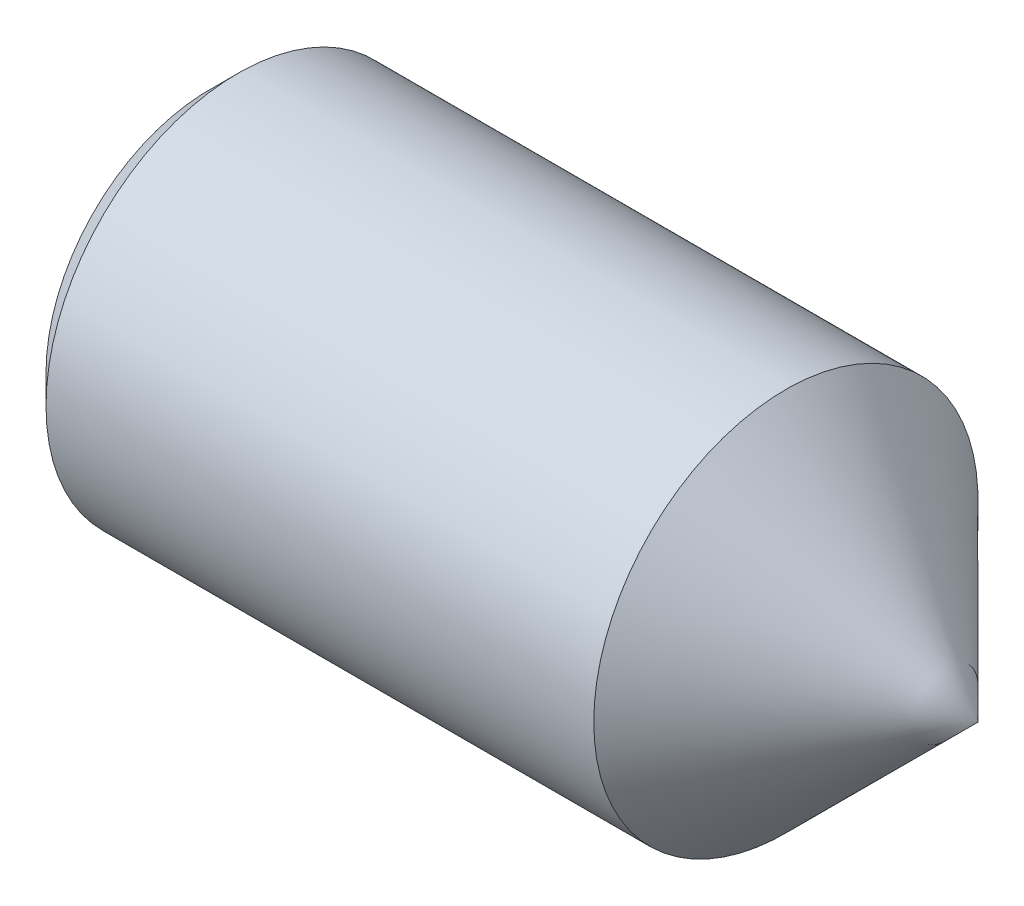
SolidWorks part; units mm, degrees
ref_plane "Plane1" through (0, 0, 0) normal (0, 0, 1) x (1, 0, 0)
ref_plane "Plane2" through (0, 0, 0) normal (0, 1, 0) x (1, 0, 0)
ref_plane "Plane3" through (0, 0, 0) normal (1, 0, 0) x (0, 0, -1)
sketch "BodySke" plane through (0, 0, 0) normal (0, 0, 1) x (1, 0, 0)
  line L0 (0, 0) -> (0, 10.8102)
  line L1 (0, 10.8102) -> (1.8898, 12.7)
  line L2 (1.8898, 12.7) -> (38.1, 12.7)
  line L3 (38.1, 12.7) -> (50.8, 0)
  line L4 (50.8, 0) -> (0, 0)
  line L5 (-12.7, 0) -> (88.9, 0) construction
  line L6 (38.1, -12.7) -> (50.8, 0) construction
  line L7 (1.0541, 15.875) -> (1.0541, -3.175) construction
  line L8 (0, -10.8102) -> (1.8898, -12.7) construction
  dimension "Cone_ang" = 90
  dimension "Length" = 50.8
  dimension "Diameter" = 25.4
  dimension "Drive_ch_ang" = 45
  dimension "Minor_dia" = 21.6205
  dimension "Advance" = 2.1082
revolve "BaseBody" add sketch "BodySke" angle 360 about L5
sketch "Sketch2" plane through (0, 0, 0) normal (-1, 0, 0) x (0, 0, 1)
  line L0 (4.1208, 7.1374) -> (-4.1208, 7.1374)
  line L1 (-4.1208, 7.1374) -> (-8.2416, 0)
  line L2 (4.1208, 7.1374) -> (8.2416, 0)
  line L3 (4.1208, -7.1374) -> (8.2416, 0)
  line L4 (4.1208, -7.1374) -> (-4.1208, -7.1374)
  line L5 (-4.1208, -7.1374) -> (-8.2416, 0)
  dimension "Hex_size" = 14.2748
  dimension "D2" = 7.1374
  dimension "D3" = 7.1374
extrude "Hex" cut sketch "Sketch2" against normal blind 14.2748
sketch "Sketch4" plane through (0, 4.7709, -0.5249) normal (-1, 0, 0) x (0, 0, 1)
  line L0 (0.5249, -4.7709) -> (10.6976, -4.7709)
  line L1 (0.5249, -4.7709) -> (6.6732, -1.2211) construction
  line L2 (0.5249, -4.7709) -> (5.6112, 4.0389)
  line L3 (8.9666, -2.6687) -> (10.2861, -1.9069)
  line L4 (6.5663, 1.4888) -> (7.8858, 2.2506)
  arc A0 (8.9666, -2.6687) -> (6.5663, 1.4888) centre (0.5249, -4.7709) ccw
  arc A1 (10.6976, -4.7709) -> (10.2861, -1.9069) centre (0.5249, -4.7709) ccw
  arc A2 (5.6112, 4.0389) -> (7.8858, 2.2506) centre (0.5249, -4.7709) cw
  circle A3 centre (0.5249, -4.7709) radius 8.6995 construction
  circle A4 centre (0.5249, -4.7709) radius 10.1727 construction
  dimension "D1" = 30
  dimension "Spline_n_dim" = 17.399
  dimension "Spline_m_dim" = 20.3454
  dimension "Spline_a_dim" = 60
  dimension "D3" = 2.4003
  dimension "Spline_p_dim" = 4.8006
extrude "Spline" [suppressed] cut sketch "Sketch4" against normal blind 12.7
pattern_circular "CirPattern1" [suppressed] count 6 every 60 about axis through (-12.7, 0, 0) along (1, 0, 0)
sketch "ThdSchSke" plane through (0, 0, 0) normal (0, 0, 1) x (1, 0, 0)
  line L0 (1.8898, -10.8102) -> (0.5665, -12.7)
  line L1 (1.8898, -10.8102) -> (3.213, -12.7)
  line L2 (3.213, -12.7) -> (3.213, -15.875)
  line L3 (-3.175, 0) -> (5.1513, 0) construction
  line L4 (1.8898, 12.7) -> (1.8898, -12.7) construction
  line L5 (3.213, -15.875) -> (0.5665, -15.875)
  line L6 (0.5665, -15.875) -> (0.5665, -12.7)
  dimension "Thread_minor" = 21.6205
  dimension "Diameter" = 25.4
  dimension "SideAngle" = 55
  dimension "VeeAngle" = 70
  dimension "Overcut" = 31.75
revolve "ThreadSchematic" [suppressed] cut sketch "ThdSchSke" angle 360 about L3
pattern_linear "ThdSchPat" [suppressed]
equation "\"D2@Sketch2\" = \"Hex_size@Sketch2\" / 2"
equation "\"D3@Sketch2\" = \"Hex_size@Sketch2\" / 2"
equation "\"Thread_minor@ThreadCosmetic\" = \"Minor_dia@BodySke\""
equation "\"D1@Sketch4\" = \"Spline_a_dim@Sketch4\" / 2"
equation "\"D3@Sketch4\" = \"Spline_p_dim@Sketch4\" / 2"
equation "\"D2@CirPattern1\" = \"Spline_a_dim@Sketch4\""
equation "\"Num_teeth@CirPattern1\" = 360 / \"D2@CirPattern1\""
equation "\"Thread_minor@ThdSchSke\" = \"Thread_minor@ThreadCosmetic\""
equation "\"Diameter@ThdSchSke\" = \"Diameter@BodySke\""
equation "\"Overcut@ThdSchSke\" = \"Diameter@BodySke\" * 1.25"
equation "\"Num_threads@ThdSchPat\" = int( (\"Length@BodySke\" - ( ( ( \"Diameter@BodySke\" - \"Minor_dia@BodySke\" ) * 0.5 ) / tan( \"Drive_ch_ang@BodySke\" * 0.017453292 ) ) - ( ( \"Diameter@BodySke\" * 0.5 ) / tan( \"Con"
equation "\"Advance@ThdSchPat\" = (\"Length@BodySke\" - ( ( ( \"Diameter@BodySke\" - \"Minor_dia@BodySke\" ) * 0.5 ) / tan( \"Drive_ch_ang@BodySke\" * 0.017453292 ) ) - ( ( \"Diameter@BodySke\" * 0.5 ) / tan( \"Cone_ang@Bod"
equation "' \"Num_threads@ThdSchPat\" = \"Num_threads@ThdSchPat\" - sgn( \"Num_threads@ThdSchPat\" - 1) '---chamfered tips only---"
